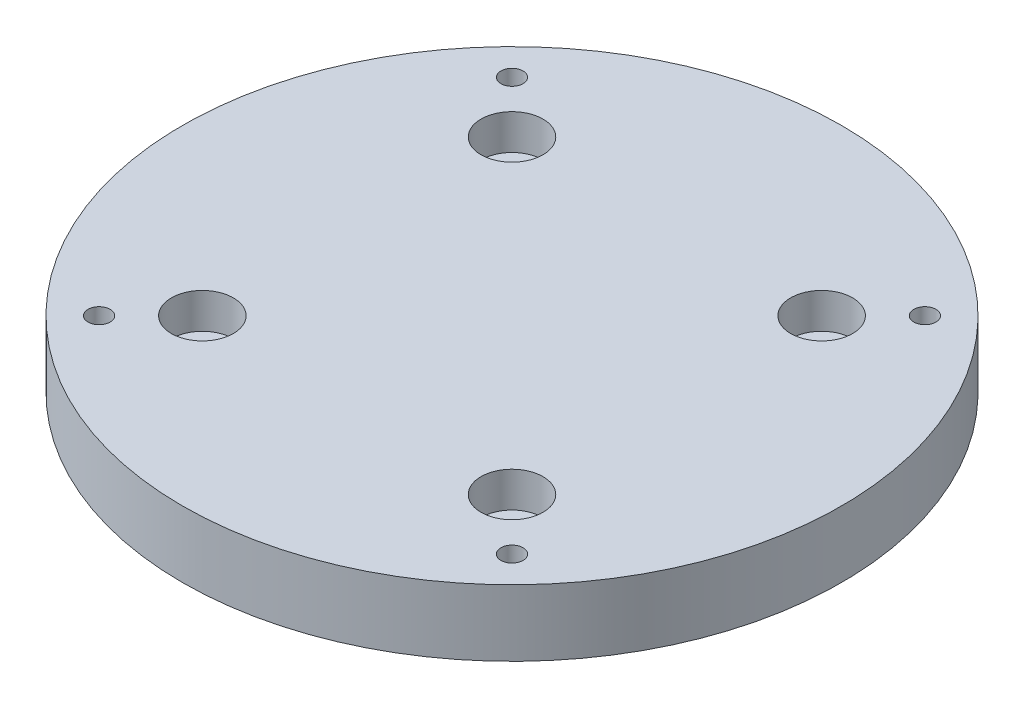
SolidWorks part; units mm, degrees
ref_plane "Plan de face" through (0, 0, 0) normal (0, 0, 1) x (1, 0, 0)
ref_plane "Plan de dessus" through (0, 0, 0) normal (0, 1, 0) x (1, 0, 0)
ref_plane "Plan de droite" through (0, 0, 0) normal (1, 0, 0) x (0, 0, -1)
sketch "Esquisse1" plane through (0, 0, 0) normal (0, 1, 0) x (1, 0, 0)
  circle A0 centre (0, 0) radius 74.5
  dimension "D1" = 149
extrude "Boss.-Extru.1" add sketch "Esquisse1" along normal blind 15
hole_wizard "Trou taraudé M6x1.01" positions "Esquisse2" profile "Esquisse3" tap size "M6x1.0" standard "Ansi Metric"
sketch "Esquisse2" plane through (0, 15, 0) normal (0, 1, 0) x (1, 0, 0)
  line L1 (-46.669, -46.669) -> (46.669, -46.669) construction
  line L2 (-46.669, -46.669) -> (-46.669, 46.669) construction
  line L3 (-46.669, 46.669) -> (46.669, 46.669) construction
  line L4 (46.669, -46.669) -> (46.669, 46.669) construction
  line L5 (-46.669, -46.669) -> (46.669, 46.669) construction
  line L6 (-46.669, 46.669) -> (46.669, -46.669) construction
  circle A0 centre (0, 0) radius 66 construction
  point P0 (46.669, 46.669)
  point P2 (-46.669, 46.669)
  point P4 (-46.669, -46.669)
  point P6 (46.669, -46.669)
  point P83 (0, 0)
  point P84 (0, 0)
  point P85 (0, 0)
  point P86 (0, 0)
  dimension "D1" = 132
sketch "Esquisse3" plane through (46.669, 15, -46.669) normal (1, 0, 0) x (0, 0, 1)
  line L0 (0, 0) -> (0, 15)
  line L1 (0, 15) -> (2.5, 15)
  line L2 (2.5, 15) -> (2.5, 0)
  line L5 (2.5, 0) -> (0, 0)
  line L11 (0, -6.35) -> (0, 107.95) construction
  dimension "Diamètre du trou pour taraudage jusqu'au prochain" = 5
  dimension "Profondeur du trou pour taraudage jusqu'au prochain" = 15
sketch "Esquisse4" plane through (0, 15, 0) normal (0, 1, 0) x (1, 0, 0)
  line L1 (-35, -35) -> (35, -35) construction
  line L2 (-35, -35) -> (-35, 35) construction
  line L3 (-35, 35) -> (35, 35) construction
  line L4 (35, -35) -> (35, 35) construction
  line L5 (-35, -35) -> (35, 35) construction
  line L6 (-35, 35) -> (35, -35) construction
  circle A0 centre (-35, 35) radius 4.05
  circle A1 centre (35, 35) radius 4.05
  circle A2 centre (35, -35) radius 4.05
  circle A3 centre (-35, -35) radius 4.05
  point P0 (0, 0)
  dimension "D2" = 8.1
  dimension "D1" = 70
extrude "Enlèv. mat.-Extru.1" cut sketch "Esquisse4" against normal through all
sketch "Esquisse5" plane through (0, 15, 0) normal (0, 1, 0) x (1, 0, 0)
  circle A0 centre (-35, 35) radius 7
  circle A1 centre (35, 35) radius 7
  circle A2 centre (35, -35) radius 7
  circle A3 centre (-35, -35) radius 7
  dimension "D1" = 14
extrude "Enlèv. mat.-Extru.2" cut sketch "Esquisse5" against normal blind 8
